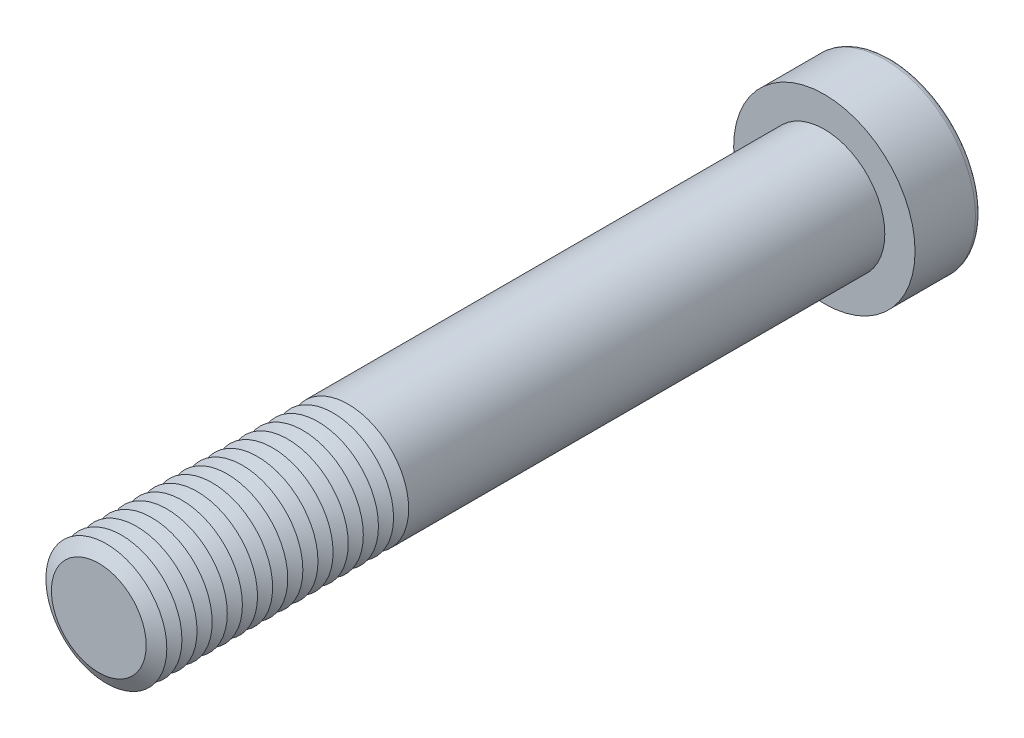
SolidWorks part; units mm, degrees
ref_plane "Front Plane" through (0, 0, 0) normal (0, 0, 1) x (1, 0, 0)
ref_plane "Top Plane" through (0, 0, 0) normal (0, 1, 0) x (1, 0, 0)
ref_plane "Right Plane" through (0, 0, 0) normal (1, 0, 0) x (0, 0, -1)
sketch "Sketch1" plane through (0, 0, 0) normal (0, 0, 1) x (1, 0, 0)
  circle A0 centre (0, 0) radius 10
  dimension "D1" = 20
extrude "Boss-Extrude1" add sketch "Sketch1" along normal blind 120
sketch "Sketch2" plane through (0, 0, 0) normal (0, 0, -1) x (-1, 0, 0)
  circle A0 centre (0, 0) radius 15
  dimension "D1" = 30
extrude "Boss-Extrude2" add sketch "Sketch2" along normal blind 11
sketch "Sketch3" plane through (0, 0, -11) normal (0, 0, -1) x (-1, 0, 0)
  line L1 (-4.0415, 7) -> (-8.0829, 0)
  line L2 (-8.0829, 0) -> (-4.0415, -7)
  line L3 (-4.0415, -7) -> (4.0415, -7)
  line L4 (4.0415, -7) -> (8.0829, 0)
  line L5 (8.0829, 0) -> (4.0415, 7)
  line L6 (4.0415, 7) -> (-4.0415, 7)
  circle A0 centre (0, 0) radius 7 construction
  dimension "D1" = 14
extrude "Cut-Extrude1" cut sketch "Sketch3" against normal blind 10.5
fillet "Fillet1" radius 1 1 edges at (-15, 0, -11)
sketch "Sketch4" plane through (0, 0, -0.5) normal (0, 0, -1) x (-1, 0, 0)
  line L0 (4.0415, -7) -> (8.0829, 0) construction
  circle A0 centre (0, 0) radius 7
extrude "Cut-Extrude2" cut sketch "Sketch4" against normal through all draft 60
sketch "Sketch5" plane through (0, 0, -11) normal (0, 0, -1) x (-1, 0, 0)
  circle A0 centre (0, 0) radius 8.0829
extrude "Cut-Extrude3" cut sketch "Sketch5" against normal through all draft 75
sketch "Sketch7" plane through (0, 0, 0) normal (1, 0, 0) x (0, 0, -1)
  line L25 (-120, 7.8349) -> (-118.75, 10)
  line L26 (-120, 10) -> (-120, -10) construction
  line L27 (-118.75, 10) -> (-121.25, 10)
  line L28 (-121.25, 10) -> (-120, 7.8349)
  line L29 (0, 10) -> (-120, 10) construction
  dimension "D1" = 2.5
revolve "Cut-Revolve1" cut sketch "Sketch7" angle 360 about axis through (0, 0, 120) along (0, 0, -1)
pattern_linear "LPattern1" count 17 spacing 2.5 along (0, 0, -1) of "Cut-Revolve1"
